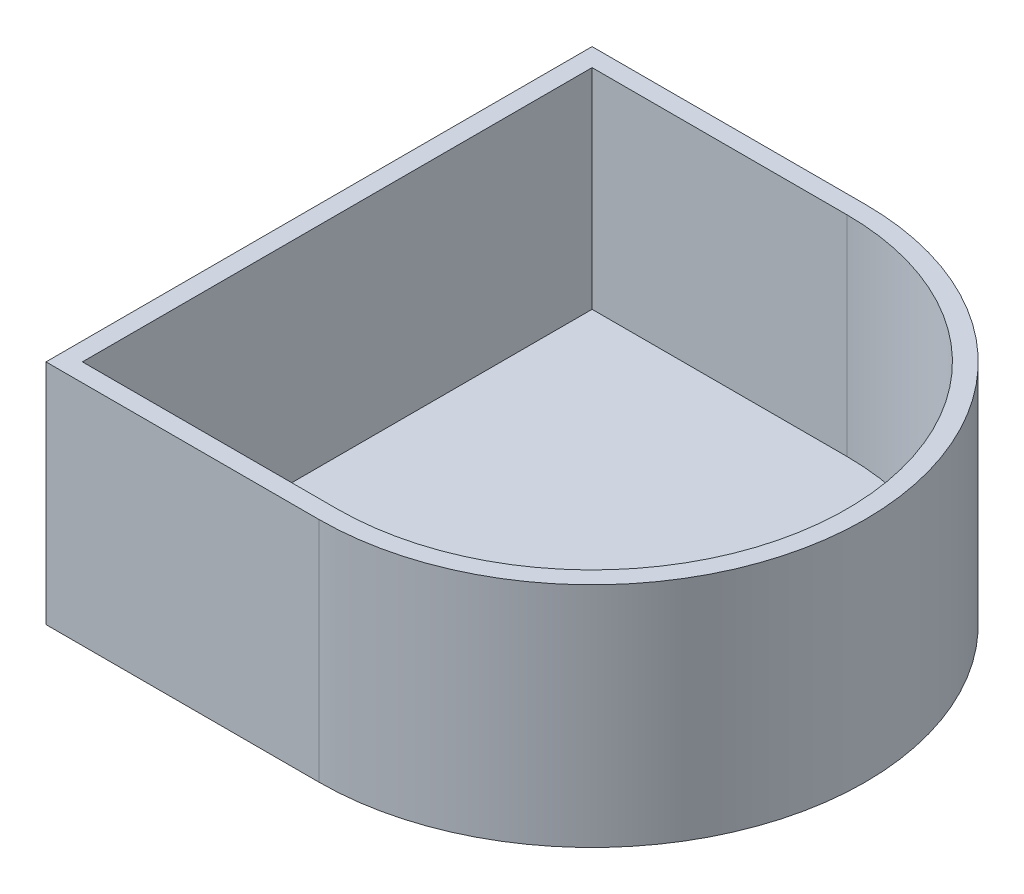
SolidWorks part; units mm, degrees
ref_plane "Front Plane" through (0, 0, 0) normal (0, 0, 1) x (1, 0, 0)
ref_plane "Top Plane" through (0, 0, 0) normal (0, 1, 0) x (1, 0, 0)
ref_plane "Right Plane" through (0, 0, 0) normal (1, 0, 0) x (0, 0, -1)
sketch "Sketch1" plane through (0, 0, 0) normal (0, 1, 0) x (1, 0, 0)
  line L0 (-15, 30) -> (15, -30) construction
  line L1 (-15, -30) -> (15, -30)
  line L2 (-15, -30) -> (-15, 30)
  line L3 (-15, 30) -> (15, 30)
  arc A0 (15, -30) -> (15, 30) centre (15, 0) ccw
  dimension "D2" = 30
  dimension "D1" = 30
extrude "Extrude1" add sketch "Sketch1" along normal blind 25
shell "Shell1" thickness 2
ref_plane "Plane1" through (70, 0, 0) normal (1, 0, 0) x (0, 0, -1)
sketch "Sketch2" plane through (70, 0, 0) normal (1, 0, 0) x (0, 0, -1)
  line L0 (30, 25) -> (30, 0) construction
  line L2 (30, 25) -> (-30, 25) construction
  line L3 (-5.5, 15.5) -> (5.5, 15.5)
  line L4 (-13.1444, 17.25) -> (13.1444, 17.25)
  line L5 (-5.5, 9.5) -> (5.5, 9.5)
  line L6 (-13.1444, 7.75) -> (13.1444, 7.75)
  line L7 (-5.5, 21.5) -> (5.5, 21.5)
  line L9 (-5.5, 3.5) -> (5.5, 3.5)
  line L10 (-14.5, 12.5) -> (14.5, 12.5)
  line L11 (-10.5, 19.9833) -> (-10.5, 5.0167)
  line L13 (-3.75, 21.5) -> (-3.75, 3.5)
  line L14 (3.75, 21.5) -> (3.75, 3.5)
  line L16 (10.5, 19.9833) -> (10.5, 5.0167)
  arc A0 (-5.5, 15.5) -> (-5.5, 9.5) centre (-5.5, 12.5) ccw
  arc A1 (5.5, 9.5) -> (5.5, 15.5) centre (5.5, 12.5) ccw
  arc A2 (-5.5, 21.5) -> (-5.5, 3.5) centre (-5.5, 12.5) ccw
  arc A3 (5.5, 21.5) -> (5.5, 3.5) centre (5.5, 12.5) cw
  dimension "D5" = 3.5
  dimension "D6" = 9.5
  dimension "D7" = 4.75
  dimension "D10" = 7.5
  dimension "D3" = 9
  dimension "D4" = 3
  dimension "D1" = 29
  dimension "D2" = 5.5
  dimension "D8" = 21
  dimension "D9" = 3.75
